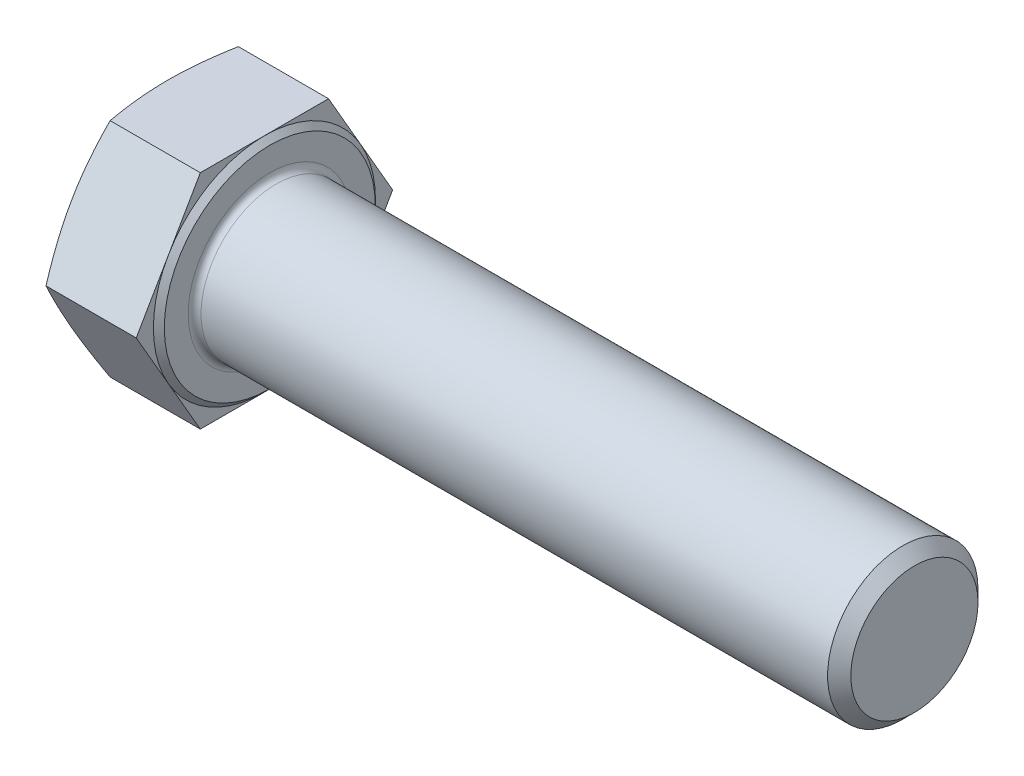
SolidWorks part; units mm, degrees
ref_plane "Front" through (0, 0, 0) normal (0, 0, 1) x (1, 0, 0)
ref_plane "Top" through (0, 0, 0) normal (0, 1, 0) x (1, 0, 0)
ref_plane "Right" through (0, 0, 0) normal (1, 0, 0) x (0, 0, -1)
sketch "Sketch-BaseHead" plane through (0, 0, 0) normal (1, 0, 0) x (0, 0, -1)
  line L1 (11.9338, 0) -> (5.9669, 10.335)
  line L2 (5.9669, 10.335) -> (-5.9669, 10.335)
  line L3 (-5.9669, 10.335) -> (-11.9338, 0)
  line L4 (-11.9338, 0) -> (-5.9669, -10.335)
  line L5 (-5.9669, -10.335) -> (5.9669, -10.335)
  line L6 (5.9669, -10.335) -> (11.9338, 0)
  circle A0 centre (0, 0) radius 10.335 construction
  dimension "s" = 20.67
extrude "BaseHead" add sketch "Sketch-BaseHead" along normal blind 8.98
sketch "Sketch4" plane through (-0.2646, 0, 5.9169) normal (0, 1, 0) x (0, 0, -1)
  line L0 (5.9169, 3.7369) -> (5.9169, -10.4477) construction
  line L2 (17.8507, -0.2646) -> (16.2519, -0.2646)
  line L4 (16.2519, -0.2646) -> (17.8507, -0.8466)
  line L6 (17.8507, -0.8466) -> (17.8507, -0.2646)
  dimension "D1" = 20
  dimension "D2" = 20.67
revolve "HeadChamfer" cut sketch "Sketch4" angle 360 about L0
sketch "Sketch1" plane through (0, 0, 0) normal (0, 0, 1) x (1, 0, 0)
  line L0 (8.98, 0) -> (9.48, 0)
  line L1 (9.48, 0) -> (9.48, -9.82)
  line L2 (9.48, -9.82) -> (8.98, -10.335)
  line L3 (8.98, -10.335) -> (8.98, 0) construction
  line L4 (0, 0) -> (7.5821, 0) construction
  line L5 (-4.0016, 0) -> (10.1831, 0) construction
  line L6 (8.98, -10.335) -> (0.5819, -10.335) construction
  line L7 (8.98, 0) -> (8.98, -10.335)
  dimension "D1" = 10.335
  dimension "c" = 0.5
  dimension "D2" = 9.82
revolve "Revolve1" add sketch "Sketch1" angle 360 about axis through (-4.0016, 0, 0) along (1, 0, 0)
ref_plane "Plane2" through (35.48, 0, 0) normal (1, 0, 0) x (0, 0, -1)
sketch "Sketch3" plane through (9.48, 0, 0) normal (1, 0, 0) x (0, 0, -1)
  circle A0 centre (0, 0) radius 7
  dimension "d" = 14
extrude "BaseBody" add sketch "Sketch3" along normal blind 60
fillet "HeadFillet" radius 0.6 1 edges at (9.48, 0, -7)
chamfer "Chamfer1" distance 1.0825 angle 45 1 edges at (69.48, 0, -7)
equation "\"D1@Sketch1\" = \"s@Sketch-BaseHead\"/ 2"
equation "\"D2@Sketch4\" = \"s@Sketch-BaseHead\""
equation "\"D1@Chamfer1\" =  ( \"d@Sketch3\" - \"D2@ThreadCosmetic1\" ) / 2 "
equation "\"b@ThreadCosmetic1\" = \"l@BaseBody\" - \"lg@Plane2\""
